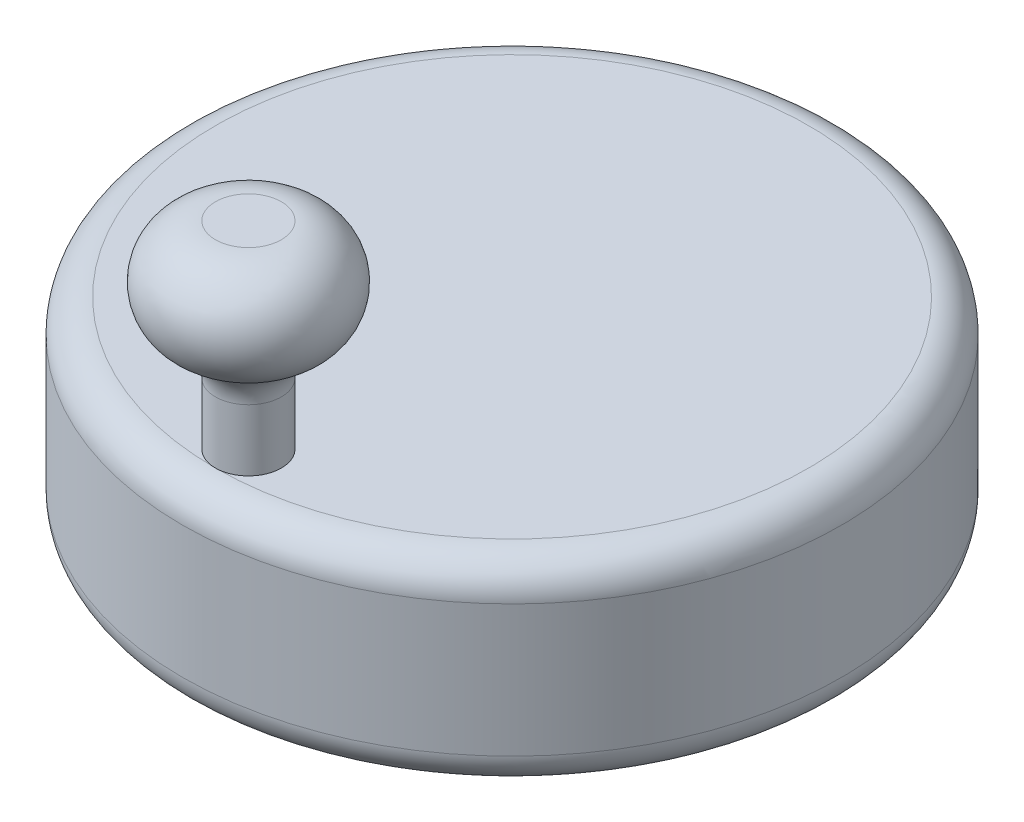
SolidWorks part; units mm, degrees
ref_plane "Front Plane" through (0, 0, 0) normal (0, 0, 1) x (1, 0, 0)
ref_plane "Top Plane" through (0, 0, 0) normal (0, 1, 0) x (1, 0, 0)
ref_plane "Right Plane" through (0, 0, 0) normal (1, 0, 0) x (0, 0, -1)
sketch "Sketch1" plane through (0, 0, 0) normal (0, 1, 0) x (1, 0, 0)
  circle A0 centre (0, 0) radius 25
  dimension "D1" = 50
extrude "Boss-Extrude1" add sketch "Sketch1" along normal blind 15
sketch "Sketch2" plane through (0, 0, 0) normal (0, -1, 0) x (1, 0, 0)
  line L1 (-1.7678, -1.7678) -> (1.7678, -1.7678)
  line L2 (-1.7678, -1.7678) -> (-1.7678, 1.7678)
  line L3 (-1.7678, 1.7678) -> (1.7678, 1.7678)
  line L4 (1.7678, -1.7678) -> (1.7678, 1.7678)
  line L5 (-1.7678, -1.7678) -> (1.7678, 1.7678) construction
  line L6 (-1.7678, 1.7678) -> (1.7678, -1.7678) construction
  circle A0 centre (0, 0) radius 2.5 construction
  point P0 (0, 0)
  dimension "D1" = 5
extrude "Cut-Extrude1" cut sketch "Sketch2" against normal blind 10
ref_plane "Plane1" through (0, 0, 20) normal (0, 0, 1) x (1, 0, 0)
sketch "Sketch3" plane through (0, 0, 20) normal (0, 0, 1) x (1, 0, 0)
  line L0 (0, 15) -> (0, 30) construction
  line L1 (25, 15) -> (-25, 15) construction
  line L2 (0, 30) -> (-2.5, 30)
  line L3 (-2.5, 19.6754) -> (-2.5, 15)
  line L4 (-2.5, 15) -> (0, 15)
  line L5 (0, 15) -> (0, 30)
  arc A0 (-2.5, 30) -> (-4.2143, 22.386) centre (-2.5, 26) ccw
  arc A1 (-4.2143, 22.386) -> (-2.5, 19.6754) centre (-5.5, 19.6754) cw
  dimension "D2" = 4
  dimension "D3" = 3
  dimension "D1" = 15
  dimension "D4" = 2.5
revolve "Revolve1" add sketch "Sketch3" angle 360 about L0
fillet "Fillet1" radius 2.5 2 edges at (0, 0, 25) (0, 15, 25)
